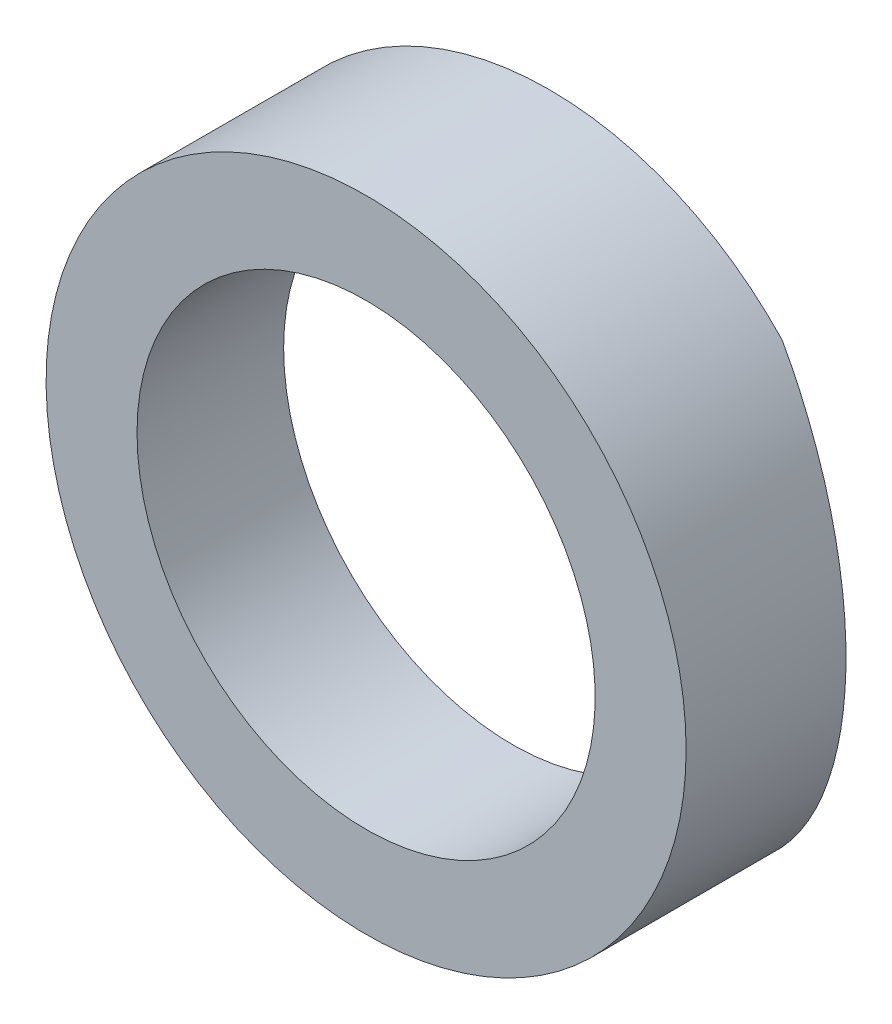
SolidWorks part; units mm, degrees
ref_plane "Front Plane" through (0, 0, 0) normal (0, 0, 1) x (1, 0, 0)
ref_plane "Top Plane" through (0, 0, 0) normal (0, 1, 0) x (1, 0, 0)
ref_plane "Right Plane" through (0, 0, 0) normal (1, 0, 0) x (0, 0, -1)
sketch "Sketch1" plane through (0, 0, 0) normal (0, 0, 1) x (1, 0, 0)
  line L0 (0, 80.3186) -> (0, -77.6575) construction
  line L1 (-71.8513, 0) -> (97.0113, 0) construction
  circle A0 centre (0, 0) radius 34.925
  dimension "D1" = 69.85
extrude "Boss-Extrude1" add sketch "Sketch1" along normal blind 20
sketch "Sketch2" plane through (0, 0, 0) normal (0, 0, -1) x (-1, 0, 0)
  circle A0 centre (0, 0) radius 25
  dimension "D1" = 50
extrude "Cut-Extrude1" cut sketch "Sketch2" against normal through all
sketch "Sketch3" plane through (0, 0, 0) normal (0, 0, -1) x (-1, 0, 0)
  circle A0 centre (0, 0) radius 31.75
  dimension "D1" = 63.5
extrude "Cut-Extrude2" cut sketch "Sketch3" against normal blind 4
sketch "Sketch4" plane through (0, 0, 0) normal (0, 1, 0) x (1, 0, 0)
  line L0 (0, -20) -> (0, 11.6678) construction
  line L1 (-34.925, -20) -> (34.925, -20) construction
  line L2 (-54.6723, -7.8435) -> (-25.4, 0)
  line L3 (-25.4, 0) -> (-54.6723, 4.6287)
  line L4 (-54.6723, 4.6287) -> (-54.6723, -7.8435)
  line L7 (34.925, 0) -> (-34.925, 0) construction
  line L8 (54.6723, 4.6287) -> (54.6723, -7.8435)
  line L9 (25.4, 0) -> (54.6723, 4.6287)
  line L10 (54.6723, -7.8435) -> (25.4, 0)
  dimension "D1" = 25.4
  dimension "D2" = 15
extrude "Cut-Extrude3" cut sketch "Sketch4" against normal through all and the other way through all
